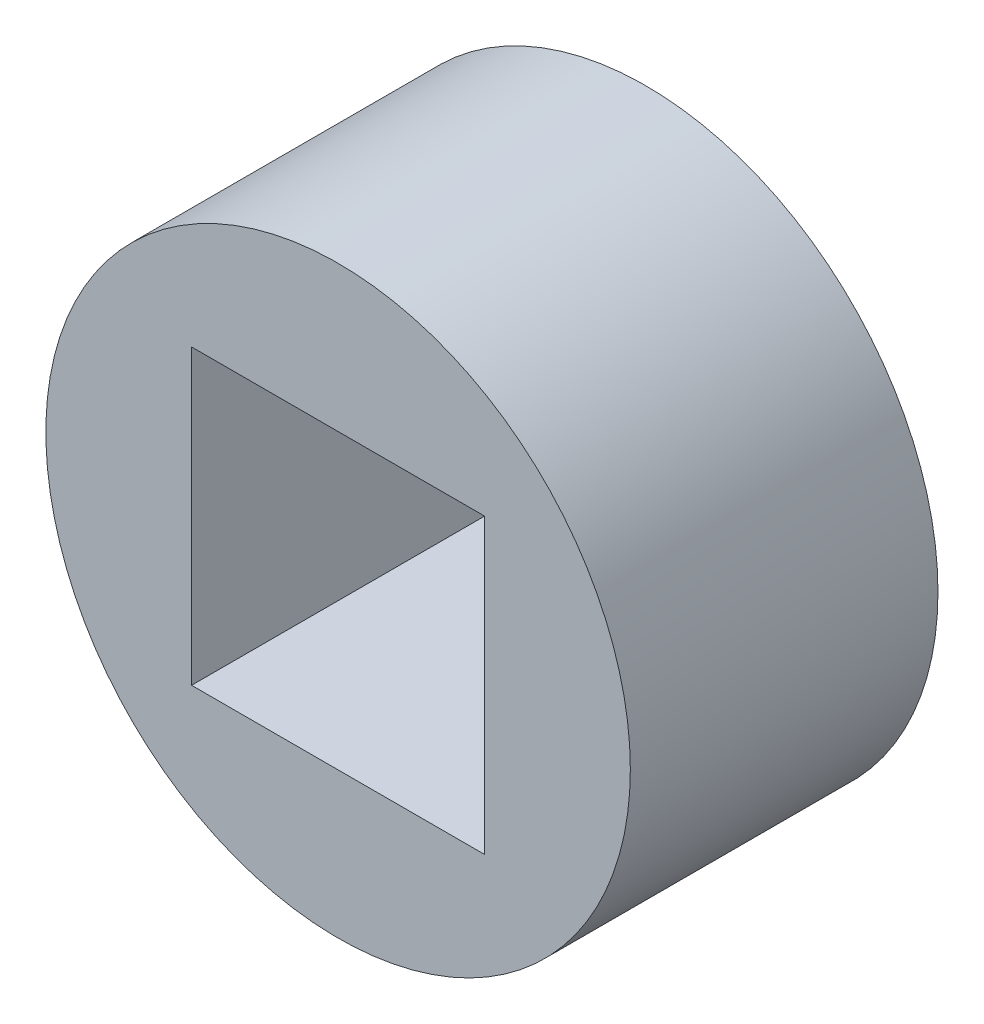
SolidWorks part; units mm, degrees
ref_plane "Front Plane" through (0, 0, 0) normal (0, 0, 1) x (1, 0, 0)
ref_plane "Top Plane" through (0, 0, 0) normal (0, 1, 0) x (1, 0, 0)
ref_plane "Right Plane" through (0, 0, 0) normal (1, 0, 0) x (0, 0, -1)
sketch "Sketch1" plane through (0, 0, 0) normal (0, 0, 1) x (1, 0, 0)
  line L1 (-4.7625, 4.7625) -> (4.7625, 4.7625)
  line L2 (-4.7625, 4.7625) -> (-4.7625, -4.7625)
  line L3 (-4.7625, -4.7625) -> (4.7625, -4.7625)
  line L4 (4.7625, 4.7625) -> (4.7625, -4.7625)
  line L5 (-4.7625, 4.7625) -> (4.7625, -4.7625) construction
  line L6 (-4.7625, -4.7625) -> (4.7625, 4.7625) construction
  circle A0 centre (0, 0) radius 9.5
  dimension "D1" = 9.525
  dimension "D2" = 19
  dimension "D3" = 9.525
extrude "Boss-Extrude1" add sketch "Sketch1" along normal blind 10
